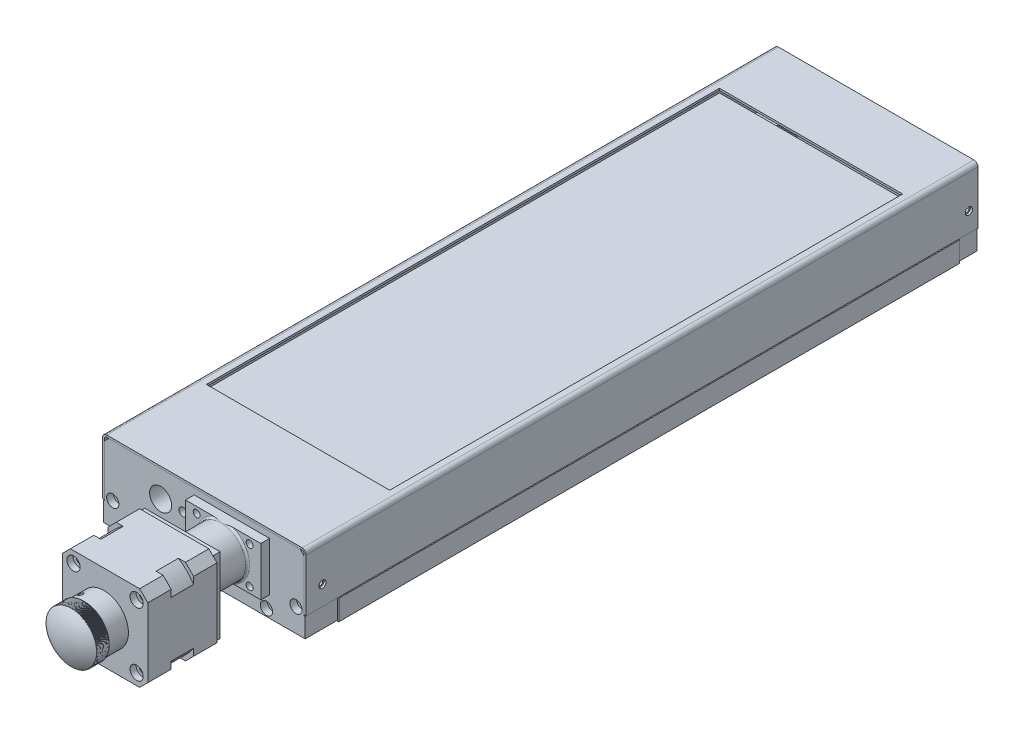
SolidWorks part; units mm, degrees
other "NONE"
ref_plane "Plan de face" through (0, 0, 0) normal (0, 0, 1) x (1, 0, 0)
ref_plane "Plan de dessus" through (0, 0, 0) normal (0, 1, 0) x (1, 0, 0)
ref_plane "Plan de droite" through (0, 0, 0) normal (1, 0, 0) x (0, 0, -1)
imported_body "Importée1"
imported_body "Importée3"
imported_body "Importée4"
imported_body "Importée5"
imported_body "Importée6"
imported_body "Importée7"
imported_body "Importée8"
imported_body "Importée9"
imported_body "Importée10"
imported_body "Importée11"
imported_body "Importée12"
delete or keep bodies "Corps-Supprimer/Garder 1" type delete bodies bodies 106 101 105
delete or keep bodies "Corps-Supprimer/Garder 2" [suppressed] type keep bodies bodies 106 105 101
sketch "Esquisse1" plane through (50, 0, 0) normal (1, 0, 0) x (0, 0, -1)
  line L1 (99.3245, 55.9843) -> (99.3246, 55.9843)
  line L2 (99.3245, 55.9843) -> (99.3245, -13.3347)
  line L3 (99.3245, -13.3347) -> (99.3246, -13.3347)
  line L4 (99.3246, 55.9843) -> (99.3246, -13.3347)
  dimension "D1" = 0.0001
extrude "Enlèv. mat.-Extru.1" cut sketch "Esquisse1" against normal through all
sketch "Esquisse2" [suppressed] plane through (0, 36.5, 0) normal (0, 1, 0) x (1, 0, 0)
  line L0 (-45, 131) -> (45, 131)
  line L1 (-45, 30) -> (-45, 232) construction
  line L2 (45, 232) -> (45, 30) construction
ref_plane "Plan1" [suppressed] through (0, 0, -131) normal (0, 0, -1) x (-1, 0, 0)
pattern_linear "Répétition linéaire1" count 2 spacing 50 along (0, 0, -1)
delete or keep bodies "Corps-Supprimer/Garder 3" type delete bodies bodies 115 114 113 118 123 112
sketch "Esquisse3" plane through (0, 0, -149.3246) normal (0, 0, 1) x (1, 0, 0)
  line L4 (-45, 35.5) -> (45, 35.5)
  line L5 (45, 35.5) -> (45, 36.5)
  line L6 (45, 36.5) -> (-45, 36.5)
  line L7 (-45, 36.5) -> (-45, 35.5)
  line L8 (-45, 35.5) -> (45, 35.5)
  line L9 (45, 35.5) -> (45, 36.5)
  line L10 (45, 36.5) -> (-45, 36.5)
  line L11 (-45, 36.5) -> (-45, 35.5)
  line L18 (50, 10) -> (49, 10)
  line L19 (49, 10) -> (49, 14)
  line L20 (49, 14) -> (30, 14)
  line L21 (30, 14) -> (30, 13.5)
  line L22 (30, 13.5) -> (21, 13.5)
  line L23 (21, 13.5) -> (21, 12.5)
  line L24 (21, 12.5) -> (13, 12.5)
  line L25 (13, 12.5) -> (13, 13.5)
  line L26 (13, 13.5) -> (-30, 13.5)
  line L27 (-30, 13.5) -> (-30, 14)
  line L28 (-30, 14) -> (-38.5, 14)
  line L29 (-38.5, 14) -> (-38.5, 15)
  line L30 (-38.5, 15) -> (-49, 15)
  line L31 (-49, 15) -> (-49, 10)
  line L32 (-49, 10) -> (-50, 10)
  line L33 (-50, 10) -> (-50, 0)
  line L34 (-50, 0) -> (50, 0)
  line L35 (50, 0) -> (50, 10)
  line L36 (50, 10) -> (49, 10)
  line L37 (49, 10) -> (49, 14)
  line L38 (49, 14) -> (30, 14)
  line L39 (30, 14) -> (30, 13.5)
  line L40 (30, 13.5) -> (21, 13.5)
  line L41 (21, 13.5) -> (21, 12.5)
  line L42 (21, 12.5) -> (13, 12.5)
  line L43 (13, 12.5) -> (13, 13.5)
  line L44 (13, 13.5) -> (-30, 13.5)
  line L45 (-30, 13.5) -> (-30, 14)
  line L46 (-30, 14) -> (-38.5, 14)
  line L47 (-38.5, 14) -> (-38.5, 15)
  line L48 (-38.5, 15) -> (-49, 15)
  line L49 (-49, 15) -> (-49, 10)
  line L50 (-49, 10) -> (-50, 10)
  line L51 (-50, 10) -> (-50, 0)
  line L52 (-50, 0) -> (50, 0)
  line L53 (50, 0) -> (50, 10)
  dimension "D1" = 0
  dimension "D2" = 0
extrude "Boss.-Extru.1" add sketch "Esquisse3" along normal up to surface (50.0001 mm away)
sketch "Esquisse4" plane through (0, 0, -149.3246) normal (0, 0, 1) x (1, 0, 0)
  line L7 (50, 10.5) -> (50, 36.5)
  line L8 (48, 38.5) -> (45, 38.5)
  line L9 (45, 38.5) -> (45, 37.5)
  line L10 (45, 37.5) -> (48, 37.5)
  line L11 (49, 36.5) -> (49, 14)
  line L12 (49, 14) -> (49, 10.5)
  line L13 (49, 10.5) -> (50, 10.5)
  line L14 (50, 10.5) -> (50, 36.5)
  line L15 (48, 38.5) -> (45, 38.5)
  line L16 (45, 38.5) -> (45, 37.5)
  line L17 (45, 37.5) -> (48, 37.5)
  line L18 (49, 36.5) -> (49, 14)
  line L19 (49, 14) -> (49, 10.5)
  line L20 (49, 10.5) -> (50, 10.5)
  line L21 (-48, 37.5) -> (-45, 37.5)
  line L22 (-45, 37.5) -> (-45, 38.5)
  line L23 (-45, 38.5) -> (-48, 38.5)
  line L24 (-50, 36.5) -> (-50, 10.5)
  line L25 (-50, 10.5) -> (-49, 10.5)
  line L26 (-49, 10.5) -> (-49, 15)
  line L27 (-49, 15) -> (-49, 36.5)
  line L28 (-48, 37.5) -> (-45, 37.5)
  line L29 (-45, 37.5) -> (-45, 38.5)
  line L30 (-45, 38.5) -> (-48, 38.5)
  line L31 (-50, 36.5) -> (-50, 10.5)
  line L32 (-50, 10.5) -> (-49, 10.5)
  line L33 (-49, 10.5) -> (-49, 15)
  line L34 (-49, 15) -> (-49, 36.5)
  arc A2 (50, 36.5) -> (48, 38.5) centre (48, 36.5) ccw
  arc A3 (49, 36.5) -> (48, 37.5) centre (48, 36.5) ccw
  arc A4 (50, 36.5) -> (48, 38.5) centre (48, 36.5) ccw
  arc A5 (49, 36.5) -> (48, 37.5) centre (48, 36.5) ccw
  arc A6 (-48, 37.5) -> (-49, 36.5) centre (-48, 36.5) ccw
  arc A7 (-48, 38.5) -> (-50, 36.5) centre (-48, 36.5) ccw
  arc A8 (-48, 37.5) -> (-49, 36.5) centre (-48, 36.5) ccw
  arc A9 (-48, 38.5) -> (-50, 36.5) centre (-48, 36.5) ccw
  dimension "D1" = 0
  dimension "D2" = 0
extrude "Boss.-Extru.2" add sketch "Esquisse4" along normal up to surface (50.0001 mm away)
sketch "Esquisse5" plane through (0, 0, -99.3245) normal (0, 0, 1) x (1, 0, 0)
  line L4 (45, 36.5) -> (-45, 36.5)
  line L5 (-45, 36.5) -> (-45, 35.5)
  line L6 (-45, 35.5) -> (45, 35.5)
  line L7 (45, 35.5) -> (45, 36.5)
  line L8 (45, 36.5) -> (-45, 36.5)
  line L9 (-45, 36.5) -> (-45, 35.5)
  line L10 (-45, 35.5) -> (45, 35.5)
  line L11 (45, 35.5) -> (45, 36.5)
  dimension "D1" = 0
extrude "Boss.-Extru.3" add sketch "Esquisse5" along normal up to surface (69.3245 mm away)
sketch "Esquisse6" plane through (0, 0, 0) normal (0, -1, 0) x (1, 0, 0)
  circle A0 centre (0, -79) radius 3.75 construction
  circle A1 centre (0, -105) radius 3.75
  circle A2 centre (0, -130) radius 3.75
  circle A3 centre (0, -180) radius 3.75 construction
  circle A4 centre (0, -231) radius 3.75 construction
other "AlignerGroupe1" parameters "D7"=13.6583, "D1"=0, "D2"=95, "D3"=121, "D4"=146, "D5"=196, "D6"=247
extrude "Enlèv. mat.-Extru.2" cut sketch "Esquisse6" against normal blind 10
sketch "Esquisse7" plane through (0, 0, 0) normal (0, -1, 0) x (1, 0, 0)
  circle A0 centre (0, -205) radius 3.75 construction
  circle A1 centre (0, -205) radius 3.75
extrude "Boss.-Extru.4" add sketch "Esquisse7" against normal blind 10
